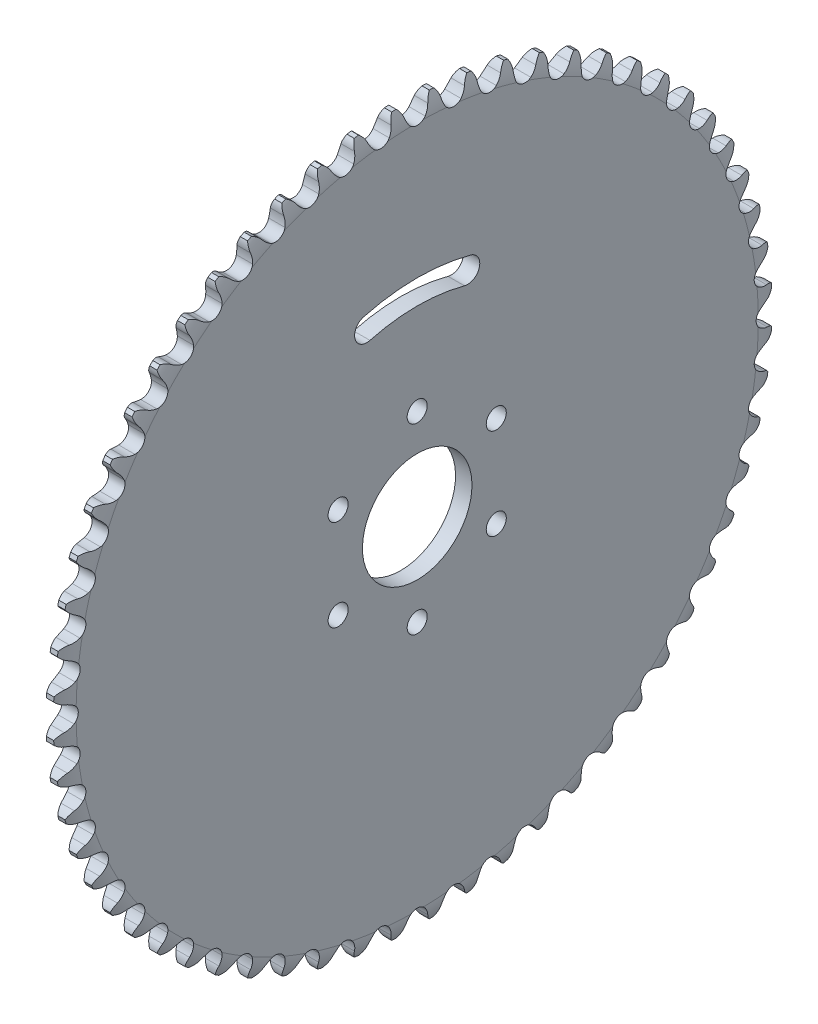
SolidWorks part; units mm, degrees
ref_plane "Front Plane" through (0, 0, 0) normal (0, 0, 1) x (1, 0, 0)
ref_plane "Top Plane" through (0, 0, 0) normal (0, 1, 0) x (1, 0, 0)
ref_plane "Right Plane" through (0, 0, 0) normal (1, 0, 0) x (0, 0, -1)
imported_body "Imported1"
sketch "Sketch1" plane through (2.1384, 0, 0) normal (1, 0, 0) x (0, 0, -1)
  line L0 (0, 0) -> (0, 50.8) construction
  line L1 (-13.148, 49.069) -> (0, 0) construction
  line L2 (0, 0) -> (13.148, 49.069) construction
  arc A0 (13.148, 49.069) -> (-13.148, 49.069) centre (0, 0) ccw construction
  arc A1 (13.9698, 52.1358) -> (-13.9698, 52.1358) centre (0, 0) ccw
  arc A2 (12.3263, 46.0022) -> (-12.3263, 46.0022) centre (0, 0) ccw
  arc A3 (12.3263, 46.0022) -> (13.9698, 52.1358) centre (13.148, 49.069) ccw
  arc A4 (-13.9698, 52.1358) -> (-12.3263, 46.0022) centre (-13.148, 49.069) ccw
  point P4 (0, 50.8)
  dimension "D3" = 6.35
  dimension "D1" = 30
  dimension "D2" = 50.8
extrude "Cut-Extrude1" cut sketch "Sketch1" against normal through all
